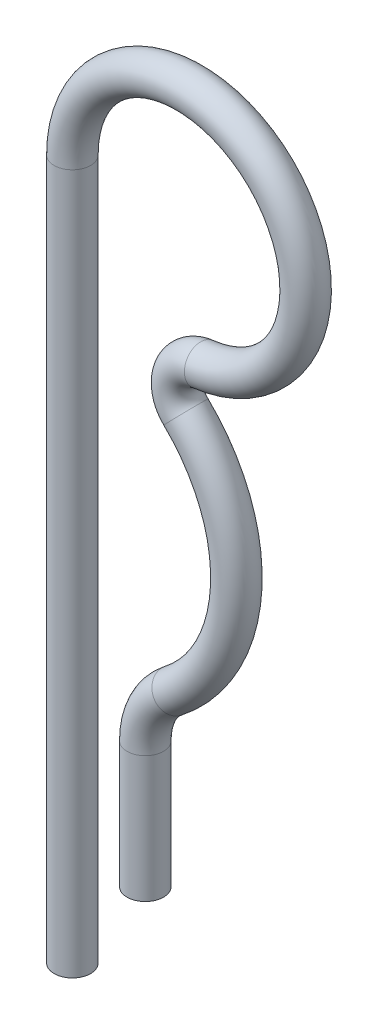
SolidWorks part; units mm, degrees
ref_plane "Plan de face" through (0, 0, 0) normal (0, 0, 1) x (1, 0, 0)
ref_plane "Plan de dessus" through (0, 0, 0) normal (0, 1, 0) x (1, 0, 0)
ref_plane "Plan de droite" through (0, 0, 0) normal (1, 0, 0) x (0, 0, -1)
sketch "Esquisse1" plane through (0, 0, 0) normal (0, 0, 1) x (1, 0, 0)
  line L0 (-5, 40.961) -> (-5, -7.039)
  line L1 (0, 8.6639) -> (0, 0)
  arc A0 (3.9413, 33.0166) -> (-5, 40.961) centre (3, 40.961) ccw
  arc A1 (1.9231, 12.6051) -> (2.7914, 29.5878) centre (-5, 21.4726) ccw
  arc A2 (3.9413, 33.0166) -> (2.7914, 29.5878) centre (4.1766, 31.0305) ccw
  arc A3 (1.9231, 12.6051) -> (0, 8.6639) centre (5, 8.6639) ccw
  point P12 (-5, 11.6034)
  dimension "D1" = 22.5
  dimension "D2" = 5
  dimension "D3" = 8
  dimension "D5" = 2
  dimension "D4" = 48
  dimension "D6" = 5
sketch "Esquisse2" plane through (0, 0, 0) normal (0, 1, 0) x (1, 0, 0)
  circle A0 centre (0, 0) radius 1.25
  dimension "D1" = 2.5
sweep "Balayage1" add profiles "Esquisse2" path "Esquisse1"
